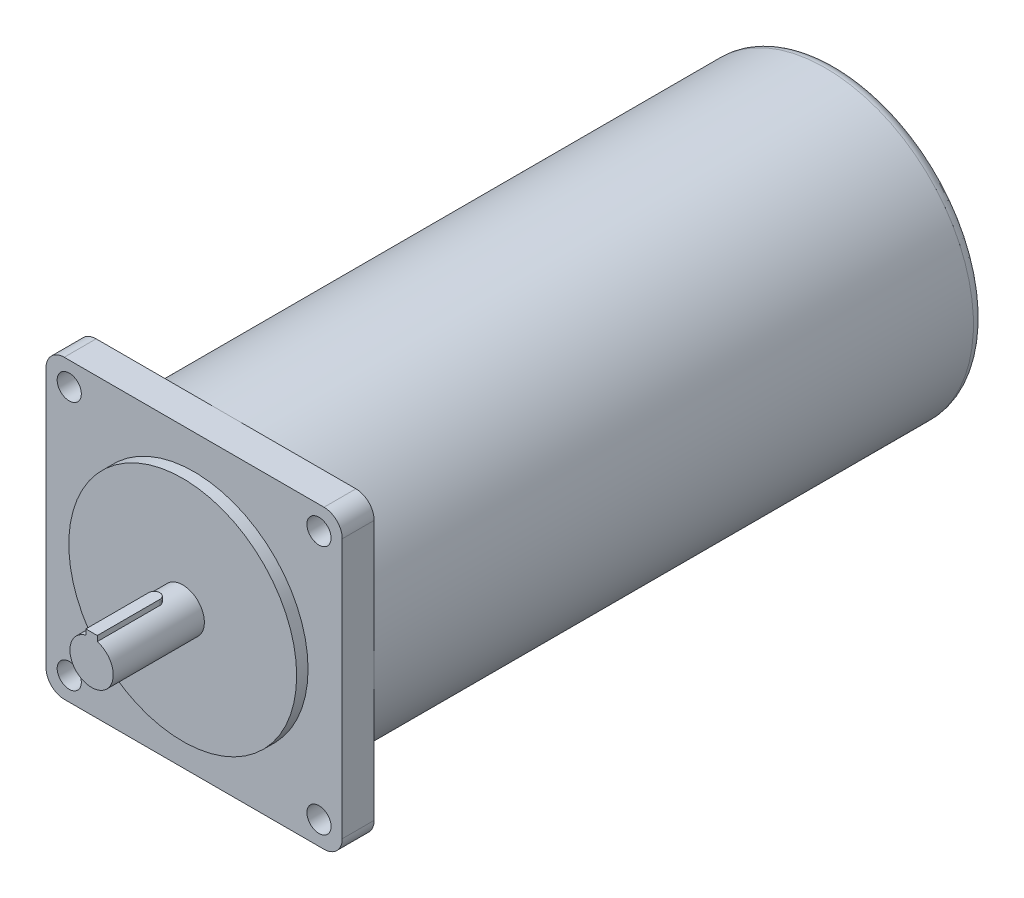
SolidWorks part; units mm, degrees
ref_plane "前视基准面" through (0, 0, 0) normal (0, 0, 1) x (1, 0, 0)
ref_plane "上视基准面" through (0, 0, 0) normal (0, 1, 0) x (1, 0, 0)
ref_plane "右视基准面" through (0, 0, 0) normal (1, 0, 0) x (0, 0, -1)
sketch "草图1" plane through (0, 0, 0) normal (0, 0, 1) x (1, 0, 0)
  circle A0 centre (0, 0) radius 50
extrude "凸台-拉伸1" add sketch "草图1" against normal blind 5
sketch "草图2" plane through (0, 0, 0) normal (0, 0, 1) x (1, 0, 0)
  circle A0 centre (0, 0) radius 9.5
extrude "凸台-拉伸2" add sketch "草图2" along normal blind 40
sketch "草图3" plane through (0, 0, 0) normal (0, 1, 0) x (1, 0, 0)
  line L1 (-9.5, -40) -> (9.5, -40) construction
  line L2 (-2.5, -12.5) -> (-2.5, -40)
  line L3 (-2.5, -40) -> (2.5, -40)
  line L4 (2.5, -40) -> (2.5, -12.5)
  arc A0 (2.5, -12.5) -> (-2.5, -12.5) centre (0, -12.5) ccw
extrude "凸台-拉伸3" add sketch "草图3" along normal blind 11.5
sketch "草图4" plane through (0, 0, -5) normal (0, 0, -1) x (-1, 0, 0)
  line L1 (0, 65) -> (57, 65)
  line L2 (65, 57) -> (65, -57)
  line L3 (57, -65) -> (-57, -65)
  line L4 (-65, -57) -> (-65, 57)
  line L5 (-57, 65) -> (0, 65)
  arc A0 (-57, -65) -> (-65, -57) centre (-57, -57) cw
  arc A1 (65, -57) -> (57, -65) centre (57, -57) cw
  arc A2 (57, 65) -> (65, 57) centre (57, 57) cw
  arc A3 (-65, 57) -> (-57, 65) centre (-57, 57) cw
  circle A4 centre (-54.8, 54.8) radius 5.3
  circle A5 centre (54.8, 54.8) radius 5.3
  circle A6 centre (54.8, -54.8) radius 5.3
  circle A7 centre (-54.8, -54.8) radius 5.3
  dimension "D1" = 8
extrude "凸台-拉伸4" add sketch "草图4" along normal blind 14
sketch "草图6" plane through (0, 0, -19) normal (0, 0, -1) x (-1, 0, 0)
  circle A0 centre (0, 0) radius 65
extrude "凸台-拉伸5" add sketch "草图6" along normal blind 268
fillet "圆角1" radius 5 1 edges at (-65, 0, -287)
